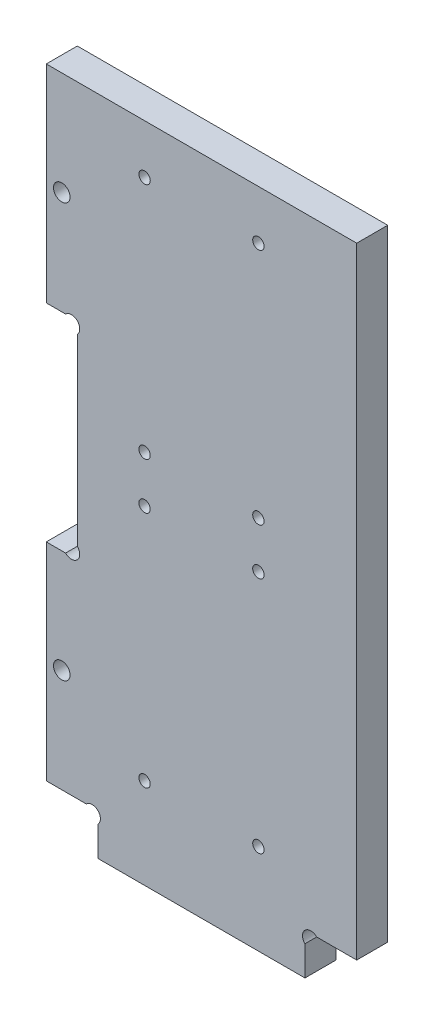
SolidWorks part; units mm, degrees
ref_plane "Face" through (0, 0, 0) normal (0, 0, 1) x (1, 0, 0)
ref_plane "Dessus" through (0, 0, 0) normal (0, 1, 0) x (1, 0, 0)
ref_plane "Droite" through (0, 0, 0) normal (1, 0, 0) x (0, 0, -1)
sketch "Esquisse1" plane through (0, 0, 0) normal (0, 0, 1) x (1, 0, 0)
  line L0 (0, -15.4544) -> (0, 152.5539) construction
  line L2 (0, 10) -> (0, 50)
  line L3 (0, 130) -> (60, 130)
  line L4 (60, 10) -> (60, 130)
  line L5 (30, -15.4544) -> (30, 152.5539) construction
  line L6 (-17.9999, 0) -> (64.1563, 0) construction
  line L7 (-17.9999, 70) -> (64.1563, 70) construction
  line L8 (-17.9999, 10) -> (64.1563, 10) construction
  line L9 (19, 128.2676) -> (19, 70.4184) construction
  line L10 (41, 128.2676) -> (41, 70.4184) construction
  line L11 (6.647, 74.5) -> (46.9427, 74.5) construction
  line L12 (6.647, 120.5) -> (46.9427, 120.5) construction
  line L13 (10, -15.4544) -> (10, 16.43) construction
  line L14 (10, 10) -> (-1.1834, -1.1834) construction
  line L15 (10, 7.7373) -> (10, 2)
  line L16 (7.7373, 10) -> (0, 10)
  line L17 (50, 7.7373) -> (50, 2)
  line L18 (52.2627, 10) -> (60, 10)
  line L19 (6, 127.625) -> (6, 65.5) construction
  line L20 (3, 118.5104) -> (3, 77.0604) construction
  line L21 (-13.5698, 90) -> (8.8686, 90) construction
  line L22 (6, 90) -> (-5.5935, 78.4065) construction
  line L23 (-13.5698, 110) -> (7.7373, 110) construction
  line L24 (3.7373, 90) -> (0, 90)
  line L25 (6, 87.7373) -> (6, 52.2627)
  line L26 (3.7373, 50) -> (0, 50)
  line L27 (7.7373, 2) -> (57.3754, 2) construction
  line L28 (0, 90) -> (0, 130)
  line L29 (10, 2) -> (50, 2)
  arc A0 (10, 7.7373) -> (7.7373, 10) centre (8.8686, 8.8686) ccw
  arc A1 (50, 7.7373) -> (52.2627, 10) centre (51.1314, 8.8686) cw
  circle A2 centre (19, 120.5) radius 1.1
  circle A3 centre (19, 74.5) radius 1.1
  circle A4 centre (41, 74.5) radius 1.1
  circle A5 centre (41, 120.5) radius 1.1
  circle A6 centre (19, 65.5) radius 1.1
  circle A7 centre (41, 65.5) radius 1.1
  circle A8 centre (41, 19.5) radius 1.1
  circle A9 centre (19, 19.5) radius 1.1
  circle A10 centre (3, 110) radius 1.6
  arc A11 (6, 87.7373) -> (3.7373, 90) centre (4.8686, 88.8686) ccw
  arc A12 (6, 52.2627) -> (3.7373, 50) centre (4.8686, 51.1314) cw
  circle A13 centre (3, 30) radius 1.6
  dimension "D7" = 30
  dimension "D8" = 10
  dimension "D9" = 45
  dimension "D13" = 45
  dimension "D10" = 6
  dimension "D15" = 8
  dimension "D1" = 10
  dimension "D2" = 60
  dimension "D3" = 4.5
  dimension "D4" = 22
  dimension "D5" = 46
  dimension "D6" = 11
  dimension "D11" = 3
  dimension "D12" = 20
  dimension "D14" = 20
extrude "Extrusion1" add sketch "Esquisse1" along normal blind 6
